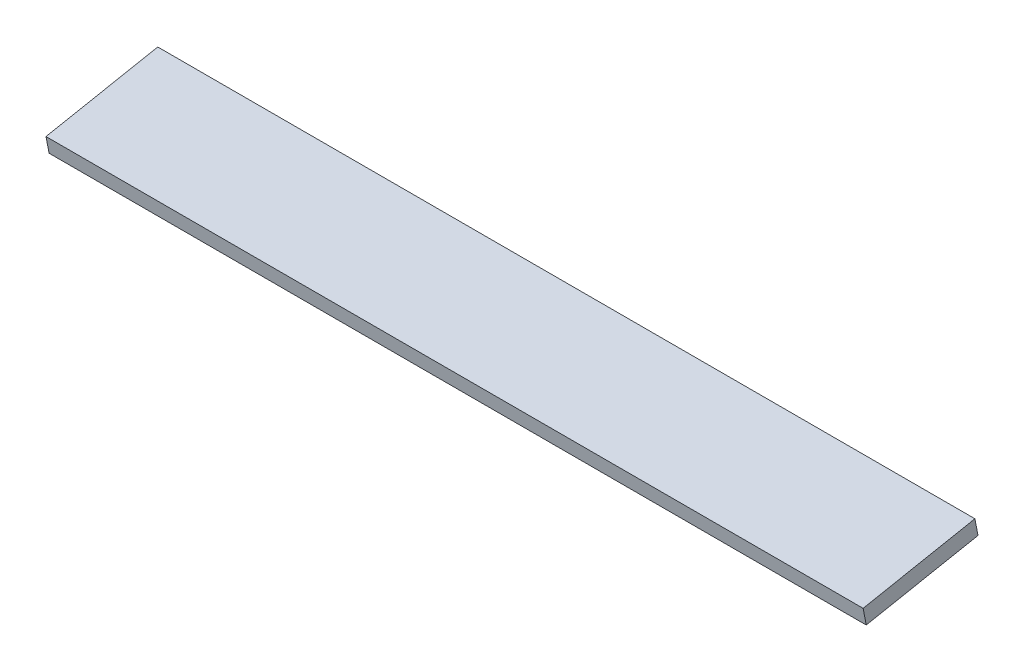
SolidWorks part; units mm, degrees
ref_plane "Alzado" through (0, 0, 0) normal (0, 0, 1) x (1, 0, 0)
ref_plane "Planta" through (0, 0, 0) normal (0, 1, 0) x (1, 0, 0)
ref_plane "Vista lateral" through (0, 0, 0) normal (1, 0, 0) x (0, 0, -1)
sketch "Croquis3" plane through (-500, 0, 0) normal (1, 0, 0) x (0, 0, -1)
  line L0 (10, 494.1528) -> (78.3838, 507.4268)
  line L1 (10, 494.1528) -> (8.0945, 503.9696)
  line L2 (78.3838, 507.4268) -> (76.4783, 517.2436)
  line L3 (8.0945, 503.9696) -> (76.4783, 517.2436)
  line L4 (71.8307, 597.6788) -> (87.3264, 517.8497) construction
  point P9 (77.7333, 507.5139)
  point P10 (73.8119, 506.0929)
  dimension "D1" = 10
extrude "Saliente-Extruir2" add sketch "Croquis3" along normal up to surface (500 mm away)
